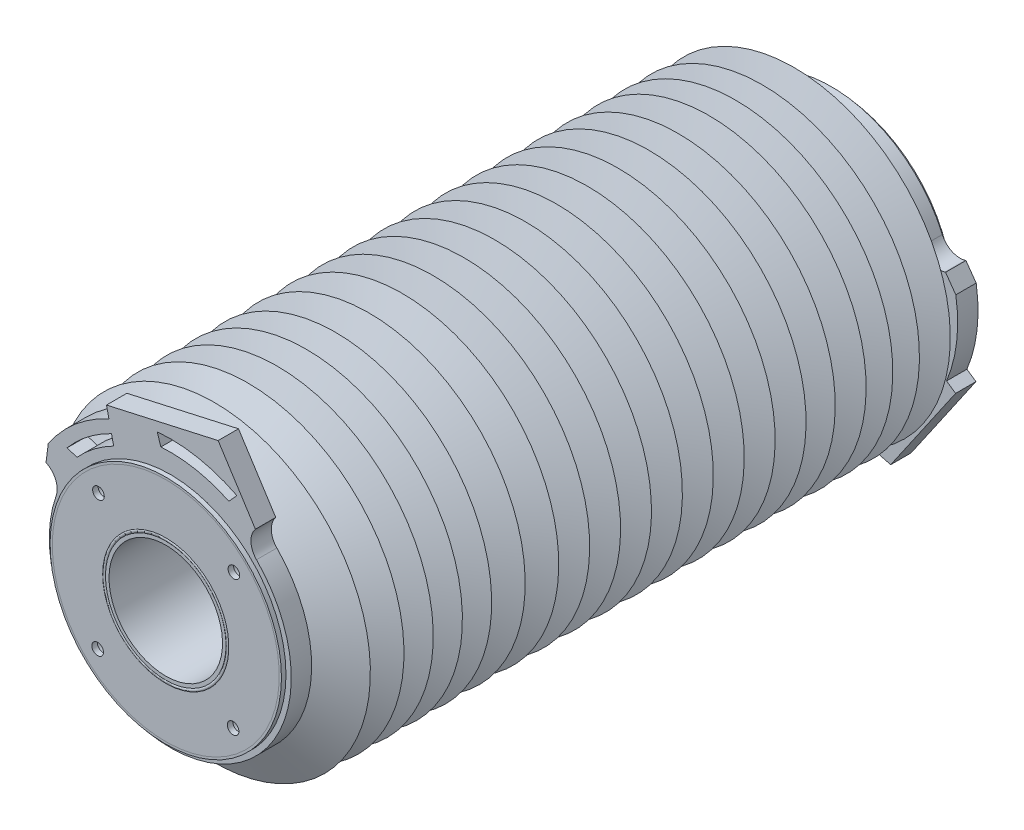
SolidWorks part; units mm, degrees
ref_plane "Front Plane" through (0, 0, 0) normal (0, 0, 1) x (1, 0, 0)
ref_plane "Top Plane" through (0, 0, 0) normal (0, 1, 0) x (1, 0, 0)
ref_plane "Right Plane" through (0, 0, 0) normal (1, 0, 0) x (0, 0, -1)
imported_body "Defeatured2"
sketch "Sketch1" plane through (0, 0, 291.6737) normal (0, 0, 1) x (1, 0, 0)
  circle A0 centre (0, 0) radius 25.4
  dimension "D1" = 50.8
extrude "Cut-Extrude1" cut sketch "Sketch1" against normal through all
